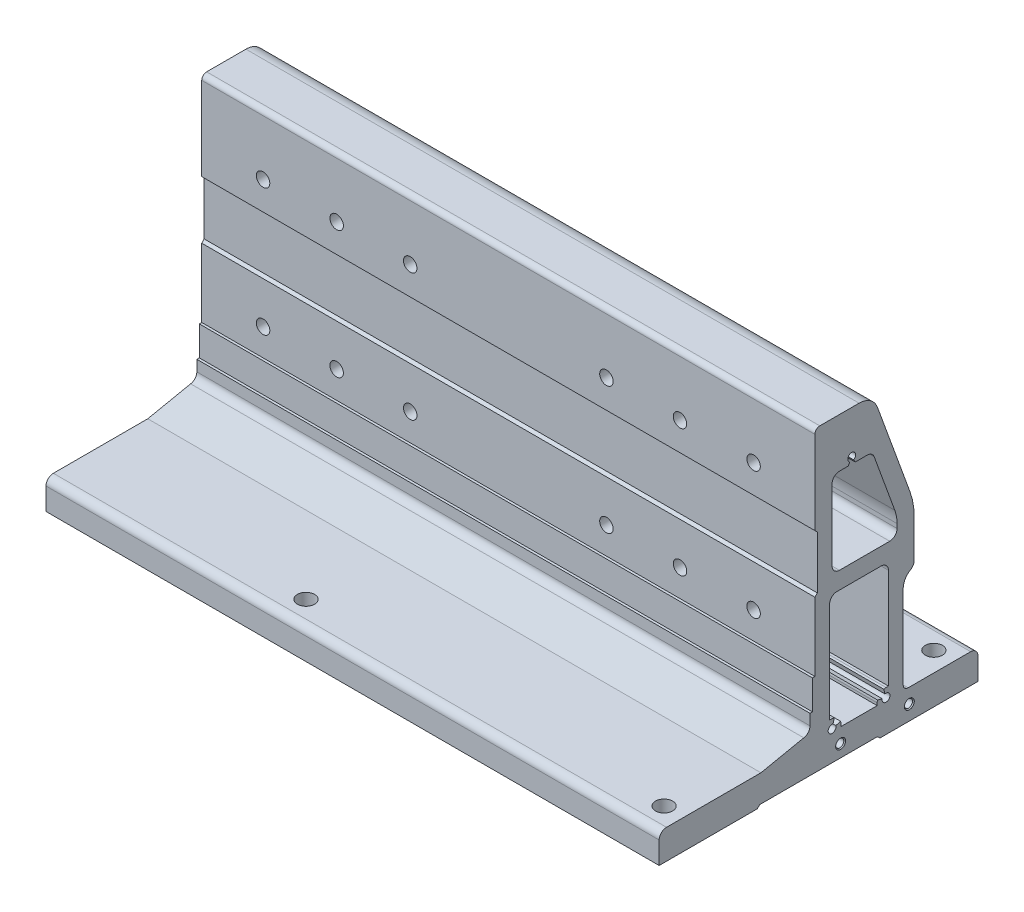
SolidWorks part; units mm, degrees
ref_plane "정면" through (0, 0, 0) normal (0, 0, 1) x (1, 0, 0)
ref_plane "윗면" through (0, 0, 0) normal (0, 1, 0) x (1, 0, 0)
ref_plane "우측면" through (0, 0, 0) normal (1, 0, 0) x (0, 0, -1)
sketch "스케치2" plane through (0, 0, 0) normal (1, 0, 0) x (0, 0, -1)
  line L0 (16.5142, 121.5) -> (0.5, 121.5)
  line L1 (-1.5, 119.5) -> (-1.5, 85.5)
  line L2 (-1.5, 85.5) -> (-0.5, 84.5)
  line L3 (-0.5, 84.5) -> (-0.5, 63)
  line L4 (-0.5, 63) -> (-1.5, 62)
  line L5 (-1.5, 62) -> (-1.5, 34)
  line L6 (-1.5, 34) -> (-2.5, 34)
  line L7 (-2.5, 34) -> (-2.5, 22)
  line L8 (-2.5, 22) -> (-3.5, 22)
  line L9 (-3.5, 22) -> (-3.5, 17.5661)
  line L10 (-6.0351, 14.6023) -> (-23.5, 11)
  line L11 (-23.5, 11) -> (-62, 11)
  line L12 (-65, 8) -> (-65, -1)
  line L13 (-65, -1) -> (-25, -1)
  line L14 (-25, -1) -> (-24, 0)
  line L15 (-24, 0) -> (24, 0)
  line L16 (24, 0) -> (25, -1)
  line L17 (25, -1) -> (65, -1)
  line L18 (65, -1) -> (65, 8)
  line L19 (62, 11) -> (36.5, 11)
  line L20 (34.5, 13) -> (34.5, 47)
  line L21 (39, 54.7942) -> (39, 69.8213)
  line L22 (37.1908, 80.0819) -> (24.0317, 116.2362)
  line L23 (25.5, 59.5) -> (7.5, 59.5)
  line L24 (4.5, 56.5) -> (4.5, 15.6)
  line L25 (4.5, 15.6) -> (5.5, 15.6)
  line L26 (6.4317, 15.4773) -> (5.9141, 13.5455)
  line L27 (7.0455, 12.4141) -> (8.9773, 12.9317)
  line L28 (9.1, 12) -> (9.1, 11)
  line L29 (9.1, 11) -> (23.9, 11)
  line L30 (23.9, 11) -> (23.9, 12)
  line L31 (24.0227, 12.9317) -> (25.9545, 12.4141)
  line L32 (27.0859, 13.5455) -> (26.5683, 15.4773)
  line L33 (27.5, 15.6) -> (28.5, 15.6)
  line L34 (28.5, 15.6) -> (28.5, 56.5)
  line L35 (12.7, 102.6144) -> (12.0566, 101.5)
  line L36 (12.0566, 101.5) -> (8.5, 101.5)
  line L37 (5.5, 98.5) -> (5.5, 69.5)
  line L38 (8.5, 66.5) -> (29, 66.5)
  line L39 (32, 69.5) -> (32, 71.2319)
  line L40 (31.0954, 76.3622) -> (22.6644, 99.5261)
  line L41 (19.8454, 101.5) -> (14.9434, 101.5)
  line L42 (14.9434, 101.5) -> (14.3, 102.6144)
  arc A0 (0.5, 121.5) -> (-1.5, 119.5) centre (0.5, 119.5) ccw
  arc A1 (-6.0351, 14.6023) -> (-3.5, 17.5661) centre (-6.5, 17.5661) ccw
  arc A2 (-62, 11) -> (-65, 8) centre (-62, 8) ccw
  arc A3 (65, 8) -> (62, 11) centre (62, 8) ccw
  arc A4 (34.5, 13) -> (36.5, 11) centre (36.5, 13) ccw
  arc A5 (37.5, 52.1962) -> (34.5, 47) centre (40.5, 47) ccw
  arc A6 (37.5, 52.1962) -> (39, 54.7942) centre (36, 54.7942) ccw
  arc A7 (39, 69.8213) -> (37.1908, 80.0819) centre (9, 69.8213) ccw
  arc A8 (24.0317, 116.2362) -> (16.5142, 121.5) centre (16.5142, 113.5) ccw
  arc A9 (7.5, 59.5) -> (4.5, 56.5) centre (7.5, 56.5) ccw
  arc A10 (6.4317, 15.4773) -> (5.5, 15.6) centre (5.5, 12) ccw
  arc A11 (5.9141, 13.5455) -> (7.0455, 12.4141) centre (5.5, 12) ccw
  arc A12 (9.1, 12) -> (8.9773, 12.9317) centre (5.5, 12) ccw
  arc A13 (24.0227, 12.9317) -> (23.9, 12) centre (27.5, 12) ccw
  arc A14 (25.9545, 12.4141) -> (27.0859, 13.5455) centre (27.5, 12) ccw
  arc A15 (27.5, 15.6) -> (26.5683, 15.4773) centre (27.5, 12) ccw
  arc A16 (28.5, 56.5) -> (25.5, 59.5) centre (25.5, 56.5) ccw
  arc A17 (14.3, 102.6144) -> (12.7, 102.6144) centre (13.5, 104) ccw
  arc A18 (8.5, 101.5) -> (5.5, 98.5) centre (8.5, 98.5) ccw
  arc A19 (5.5, 69.5) -> (8.5, 66.5) centre (8.5, 69.5) ccw
  arc A20 (29, 66.5) -> (32, 69.5) centre (29, 69.5) ccw
  arc A21 (32, 71.2319) -> (31.0954, 76.3622) centre (17, 71.2319) ccw
  arc A22 (22.6644, 99.5261) -> (19.8454, 101.5) centre (19.8454, 98.5) ccw
extrude "보스-돌출1" add sketch "스케치2" along normal mid plane 250
hole_wizard "M5 소켓 머리 캡 나사용 카운터보어1" positions "스케치3" profile "스케치4" counterbore size "M5" standard "KS"
sketch "스케치3" plane through (0, 0, -39) normal (0, 0, -1) x (-1, 0, 0)
  line L0 (-125, -1) -> (125, -1) construction
  line L1 (-125, 80.0819) -> (-125, 116.2362) construction
  point P0 (-100, 97)
  point P2 (-70, 97)
  point P4 (-40, 97)
  point P6 (-100, 45)
  point P8 (-70, 45)
  point P10 (-40, 45)
  dimension "D1" = 52
  dimension "D2" = 46
  dimension "D3" = 25
  dimension "D4" = 30
  dimension "D5" = 30
sketch "스케치4" plane through (100, 97, -39) normal (1, 0, 0) x (0, 1, 0)
  line L0 (0, 0) -> (0, 104)
  line L1 (0, 104) -> (2.75, 104)
  line L3 (2.75, 104) -> (2.75, 34.5)
  line L4 (2.75, 34.5) -> (4.75, 34.5)
  line L5 (4.75, 34.5) -> (4.75, 0)
  line L7 (4.75, 0) -> (0, 0)
  line L11 (0, -6.35) -> (0, 107.95) construction
  dimension "관통 구멍 지름" = 5.5
  dimension "관통 구멍 깊이" = 104
  dimension "카운터보어 지름" = 9.5
  dimension "카운터보어 깊이" = 34.5
pattern_linear "선형 패턴1" count 2 spacing 140 along (-1, 0, 0) of "M5 소켓 머리 캡 나사용 카운터보어1"
hole_wizard "M4 나사 구멍1" positions "스케치5" profile "스케치6" tap size "M4" standard "ISO"
sketch "스케치5" plane through (125, 0, 0) normal (1, 0, 0) x (0, 0, -1)
  line L0 (65, -1) -> (65, 8) construction
  line L1 (25, -1) -> (65, -1) construction
  point P0 (37, 5)
  point P2 (9, 5)
  dimension "D1" = 28
  dimension "D2" = 28
  dimension "D3" = 6
sketch "스케치6" plane through (125, 5, -37) normal (0, 1, 0) x (0, 0, -1)
  line L0 (0, 0) -> (0, 10.9914)
  line L1 (0, 10.9914) -> (1.65, 10)
  line L2 (1.65, 10) -> (1.65, 0.375)
  line L3 (1.65, 0.375) -> (2.025, 0)
  line L5 (2.025, 0) -> (0, 0)
  line L6 (-1.65, 0.375) -> (-2.025, 0) construction
  line L10 (0, 10.9914) -> (-1.65, 10) construction
  line L11 (0, -6.35) -> (0, 107.95) construction
  dimension "탭 드릴 지름" = 3.3
  dimension "탭 드릴 깊이" = 10
  dimension "표면 카운터싱크 지름" = 4.05
  dimension "표면 카운터싱크 각도" = 90
  dimension "드릴 각도" = 118
hole_wizard "Ø5.0mm 맞춤핀 구멍1" positions "스케치7" profile "스케치8" hole size "Ø5.0" standard "ISO"
sketch "스케치7" plane through (0, 0, 0) normal (0, -1, 0) x (-1, 0, 0)
  line L0 (0, 0) -> (-141.4129, 0) construction
  line L2 (-125, -24) -> (-125, 24) construction
  point P0 (29, 0)
  point P2 (-117, 0)
  dimension "D1" = 146
  dimension "D2" = 8
sketch "스케치8" plane through (-29, 0, 0) normal (1, 0, 0) x (0, 0, -1)
  line L0 (0, 0) -> (0, 11.5022)
  line L1 (0, 11.5022) -> (2.5, 10)
  line L2 (2.5, 10) -> (2.5, 0)
  line L5 (2.5, 0) -> (0, 0)
  line L10 (0, 11.5022) -> (-2.5, 10) construction
  line L11 (0, -6.35) -> (0, 107.95) construction
  dimension "구멍 지름" = 5
  dimension "구멍 깊이" = 10
  dimension "드릴 각도" = 118
hole_wizard "Ø7.0 (7) 지름 구멍1" positions "스케치9" profile "스케치10" hole size "Ø7.0" standard "ISO"
sketch "스케치9" plane through (0, -1, 0) normal (0, -1, 0) x (-1, 0, 0)
  line L0 (-125, -65) -> (-125, -25) construction
  line L1 (-125, 65) -> (125, 65) construction
  point P0 (29, -55)
  point P2 (-117, -55)
  point P4 (29, 55)
  point P6 (-117, 55)
  dimension "D1" = 8
  dimension "D2" = 146
  dimension "D3" = 10
  dimension "D4" = 110
sketch "스케치10" plane through (-29, -1, 55) normal (1, 0, 0) x (0, 0, -1)
  line L0 (0, 0) -> (0, 122.5)
  line L1 (0, 122.5) -> (3.5, 122.5)
  line L2 (3.5, 122.5) -> (3.5, 0)
  line L5 (3.5, 0) -> (0, 0)
  line L11 (0, -6.35) -> (0, 107.95) construction
  dimension "관통 구멍 지름" = 7
  dimension "관통 구멍 깊이" = 122.5
